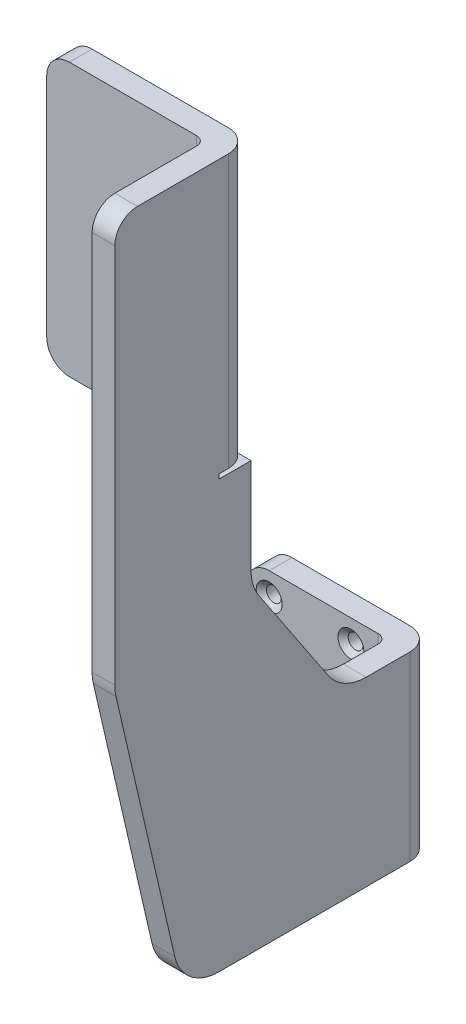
SolidWorks part; units mm, degrees
ref_plane "Front Plane" through (0, 0, 0) normal (0, 0, 1) x (1, 0, 0)
ref_plane "Top Plane" through (0, 0, 0) normal (0, 1, 0) x (1, 0, 0)
ref_plane "Right Plane" through (0, 0, 0) normal (1, 0, 0) x (0, 0, -1)
sketch "Sketch1" plane through (0, 0, 0) normal (0, 0, 1) x (1, 0, 0)
  line L1 (0, 0) -> (36, 0)
  line L2 (0, 0) -> (0, 40)
  line L3 (0, 40) -> (36, 40)
  line L4 (36, 0) -> (36, 40)
  dimension "D1" = 40
  dimension "D2" = 36
extrude "Boss-Extrude1" add sketch "Sketch1" along normal blind 5
sketch "Sketch3" plane through (36, 0, 0) normal (1, 0, 0) x (0, 0, -1)
  line L0 (-5, 40) -> (-20, 40)
  line L1 (-20, 40) -> (-40, 70)
  line L2 (-40, 70) -> (-40, 155)
  line L3 (-40, 155) -> (-70, 155)
  line L4 (-70, 155) -> (-70, 65)
  line L5 (-70, 65) -> (-55, 0)
  line L6 (-55, 0) -> (-5, 0)
  line L7 (-5, 0) -> (-5, 40) construction
  line L8 (-5, 40) -> (-5, 0)
  dimension "D1" = 50
  dimension "D2" = 65
  dimension "D3" = 15
  dimension "D4" = 65
  dimension "D5" = 30
  dimension "D6" = 30
  dimension "D7" = 90
extrude "Boss-Extrude2" add sketch "Sketch3" against normal blind 5
fillet "Fillet1" radius 5 4 edges at (36, 20, 0) (33.5, 155, 70) (0, 0, 2.5) (0, 40, 2.5)
fillet "Fillet2" radius 2 1 edges
fillet "Fillet3" radius 10 4 edges at (33.5, 65, 70) (33.5, 0, 55) (33.5, 70, 40) (33.5, 40, 20)
sketch "Sketch4" plane through (31, 0, 0) normal (-1, 0, 0) x (0, 0, 1)
  line L1 (40, 155) -> (45, 155)
  line L2 (40, 155) -> (40, 95)
  line L3 (40, 95) -> (45, 95)
  line L4 (45, 155) -> (45, 95)
  dimension "D1" = 5
  dimension "D2" = 60
extrude "Boss-Extrude3" add sketch "Sketch4" along normal blind 35
fillet "Fillet4" radius 2 1 edges at (31, 125, 45)
fillet "Fillet5" radius 5 2 edges at (-4, 95, 42.5) (-4, 155, 42.5)
sketch "Sketch5" plane through (31, 0, 0) normal (-1, 0, 0) x (0, 0, 1)
  line L0 (40, 73.0278) -> (40, 95) construction
  line L1 (40, 95) -> (47, 95)
  line L2 (40, 95) -> (40, 94)
  line L3 (40, 94) -> (47, 94)
  line L4 (47, 95) -> (47, 94)
  line L5 (47, 155) -> (47, 95) construction
  dimension "D1" = 1
extrude "Cut-Extrude1" cut sketch "Sketch5" against normal blind 10
fillet "Fillet6" radius 5 1 edges at (36, 125, 40)
sketch "Sketch6" plane through (0, 0, 0) normal (0, -1, 0) x (1, 0, 0)
  line L0 (31, 19) -> (17, 5)
  line L1 (31, 47.0449) -> (31, 7) construction
  line L2 (5, 5) -> (29, 5) construction
  line L5 (31, 19) -> (31, 7)
  line L6 (17, 5) -> (29, 5)
  arc A0 (29, 5) -> (31, 7) centre (29, 7) ccw construction
  arc A1 (29, 5) -> (31, 7) centre (29, 7) ccw
  dimension "D1" = 45
extrude "Boss-Extrude4" add sketch "Sketch6" along normal mid plane 5 from offset 20
fillet "Fillet7" radius 1 8 edges at (23, 17.5, 5) (30.4142, 17.5, 5.5858) (23, 22.5, 5) (30.4142, 22.5, 5.5858) (17, 20, 5) (31, 20, 19) (31, 17.5, 13) (31, 22.5, 13)
sketch "Sketch7" plane through (0, 0, 5) normal (0, 0, 1) x (1, 0, 0)
  line L0 (5, 35) -> (5, 5) construction
  line L1 (5, 5) -> (23, 5) construction
  line L2 (23, 5) -> (23, 35) construction
  line L3 (23, 35) -> (5, 35) construction
  point P0 (5, 35)
  point P1 (5, 5)
  dimension "D1" = 18
hole_wizard "CSK for #4 Flat Head Machine Screw (100)1" positions "Sketch9" profile "Sketch10" countersink size "#4" standard "Ansi Inch"
sketch "Sketch9" plane through (0, 0, 5) normal (0, 0, 1) x (1, 0, 0)
  point P0 (5, 35)
  point P1 (23, 35)
  point P3 (5, 5)
  point P5 (23, 5)
sketch "Sketch10" plane through (5, 35, 5) normal (1, 0, 0) x (0, -1, 0)
  line L0 (0, 0) -> (0, 20.9806)
  line L1 (0, 20.9806) -> (1.6319, 20)
  line L2 (1.6319, 20) -> (1.6319, 1.0284)
  line L3 (1.6319, 1.0284) -> (2.8575, 0)
  line L5 (2.8575, 0) -> (0, 0)
  line L6 (-1.6319, 1.0284) -> (-2.8575, 0) construction
  line L10 (0, 20.9806) -> (-1.6319, 20) construction
  line L11 (0, -6.35) -> (0, 107.95) construction
  dimension "Hole Dia." = 3.2639
  dimension "Hole Depth" = 20
  dimension "Near C'Sink Dia." = 5.715
  dimension "Near C'Sink Angle" = 100
  dimension "Drill Angle" = 118
